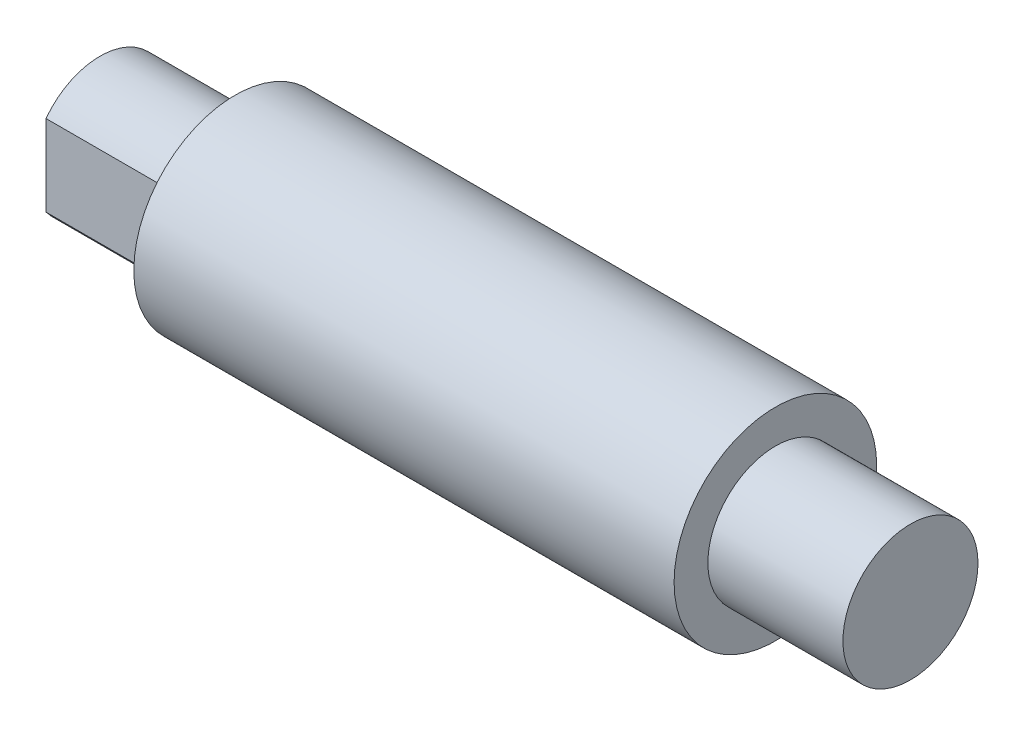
SolidWorks part; units mm, degrees
ref_plane "正面" through (0, 0, 0) normal (0, 0, 1) x (1, 0, 0)
ref_plane "平面" through (0, 0, 0) normal (0, 1, 0) x (1, 0, 0)
ref_plane "右側面" through (0, 0, 0) normal (1, 0, 0) x (0, 0, -1)
sketch "ｽｹｯﾁ1" plane through (0, 0, 0) normal (1, 0, 0) x (0, 0, -1)
  circle A0 centre (0, 0) radius 7.5
  dimension "D1" = 15
extrude "押し出し1" add sketch "ｽｹｯﾁ1" along normal blind 60
sketch "ｽｹｯﾁ2" plane through (60, 0, 0) normal (1, 0, 0) x (0, 0, -1)
  circle A0 centre (0, 0) radius 5
  dimension "D1" = 10
extrude "ｶｯﾄ - 押し出し1" cut sketch "ｽｹｯﾁ2" against normal blind 10 flip side to cut
sketch "ｽｹｯﾁ3" plane through (0, 0, 0) normal (-1, 0, 0) x (0, 0, 1)
  line L0 (-4, 3) -> (-4, -3)
  line L1 (4, -3) -> (4, 3)
  arc A0 (4, 3) -> (-4, 3) centre (0, 0) ccw
  arc A1 (-4, -3) -> (4, -3) centre (0, 0) ccw
  dimension "D2" = 10
  dimension "D1" = 8
extrude "ｶｯﾄ - 押し出し2" cut sketch "ｽｹｯﾁ3" against normal blind 10 flip side to cut
